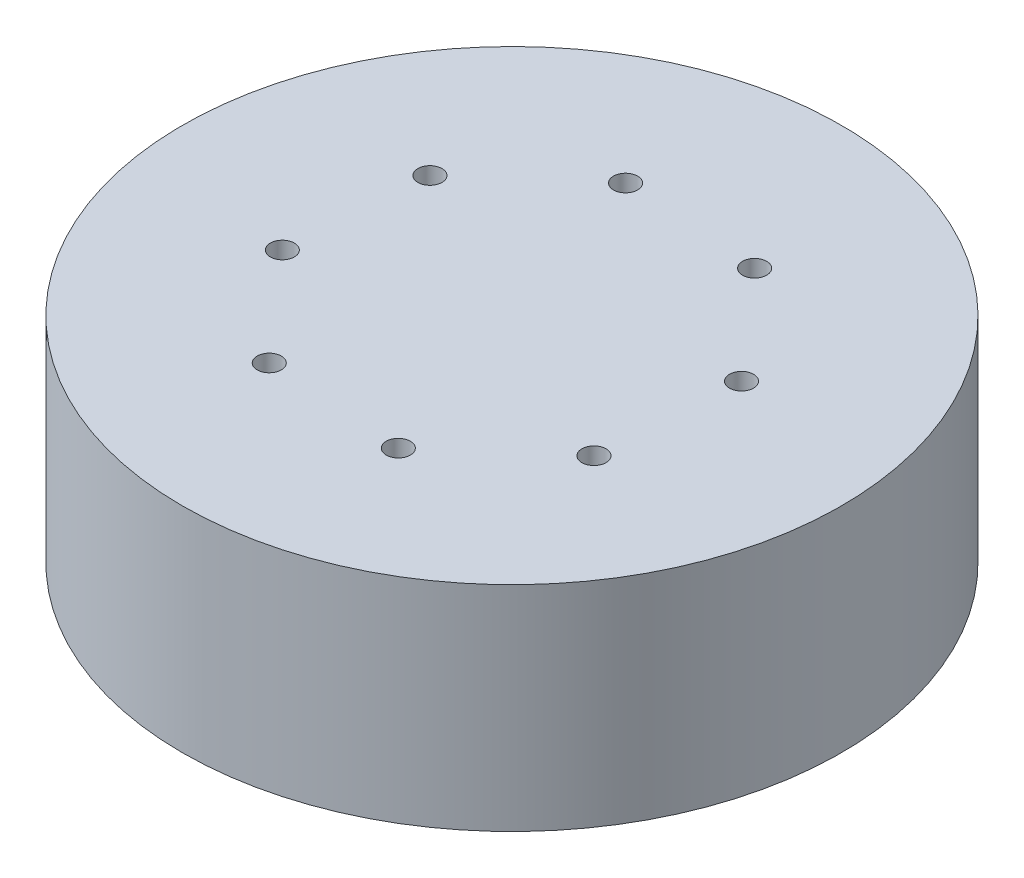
SolidWorks part; units mm, degrees
ref_plane "Ebene vorne" through (0, 0, 0) normal (0, 0, 1) x (1, 0, 0)
ref_plane "Ebene oben" through (0, 0, 0) normal (0, 1, 0) x (1, 0, 0)
ref_plane "Ebene rechts" through (0, 0, 0) normal (1, 0, 0) x (0, 0, -1)
sketch "Skizze1" plane through (0, 0, 0) normal (0, 1, 0) x (1, 0, 0)
  circle A0 centre (0, 0) radius 60.1209
extrude "Linear austragen1" add sketch "Skizze1" along normal blind 39
sketch "Skizze3" plane through (0, 39, 0) normal (0, 1, 0) x (-1, 0, 0)
  circle A0 centre (-14.6545, -29.6162) radius 2.1986
extrude "Schnitt-Linear austragen1" cut sketch "Skizze3" against normal through all
pattern_circular "Kreismuster1" count 8 every 45 about axis through (0, 0, 0) along (0, 1, 0) of "Schnitt-Linear austragen1"
